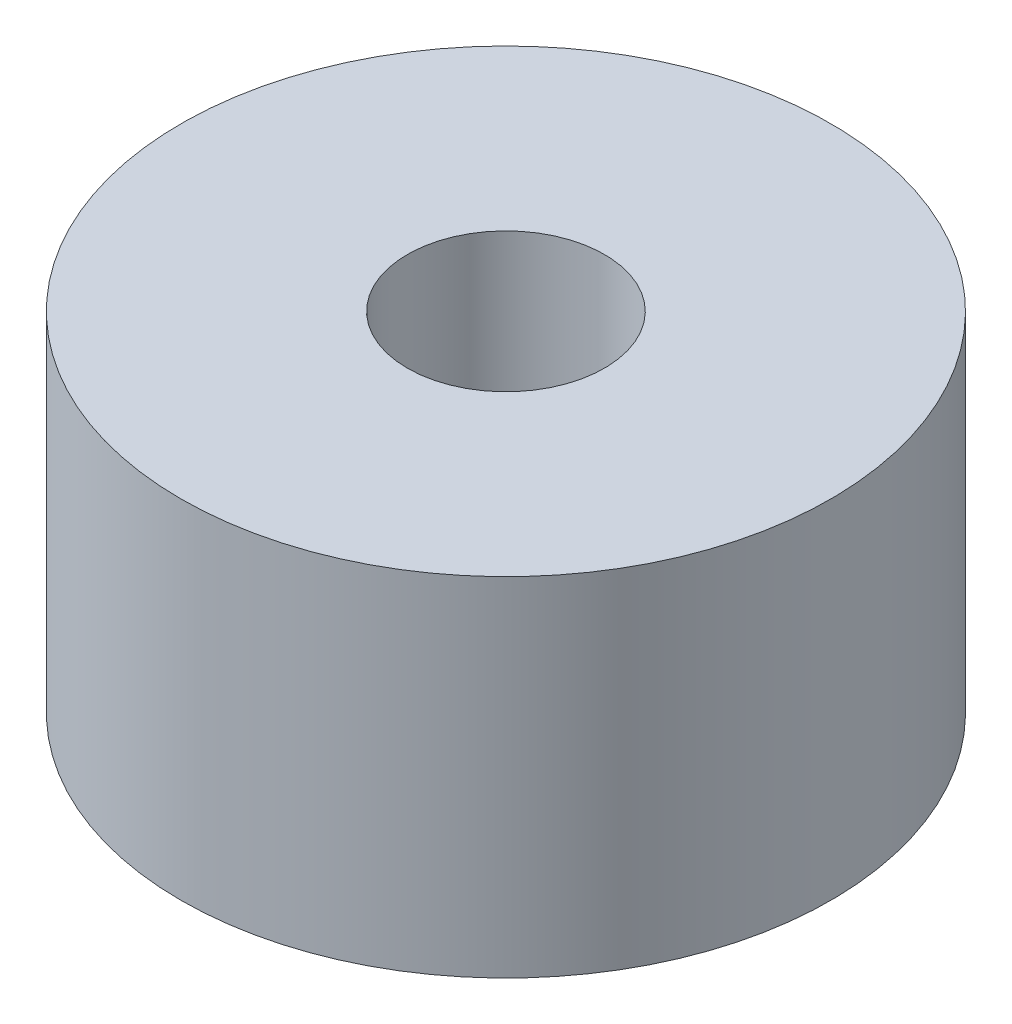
SolidWorks part; units mm, degrees
ref_plane "Front" through (0, 0, 0) normal (0, 0, 1) x (1, 0, 0)
ref_plane "Top" through (0, 0, 0) normal (0, 1, 0) x (1, 0, 0)
ref_plane "Right" through (0, 0, 0) normal (1, 0, 0) x (0, 0, -1)
sketch "Sketch1" plane through (0, 0, 0) normal (0, 1, 0) x (1, 0, 0)
  circle A0 centre (0, 0) radius 2.7305
  circle A1 centre (0, 0) radius 0.828
  dimension "D1" = 1.6561
  dimension "D2" = 5.461
extrude "Extrude1" add sketch "Sketch1" along normal blind 2.921
